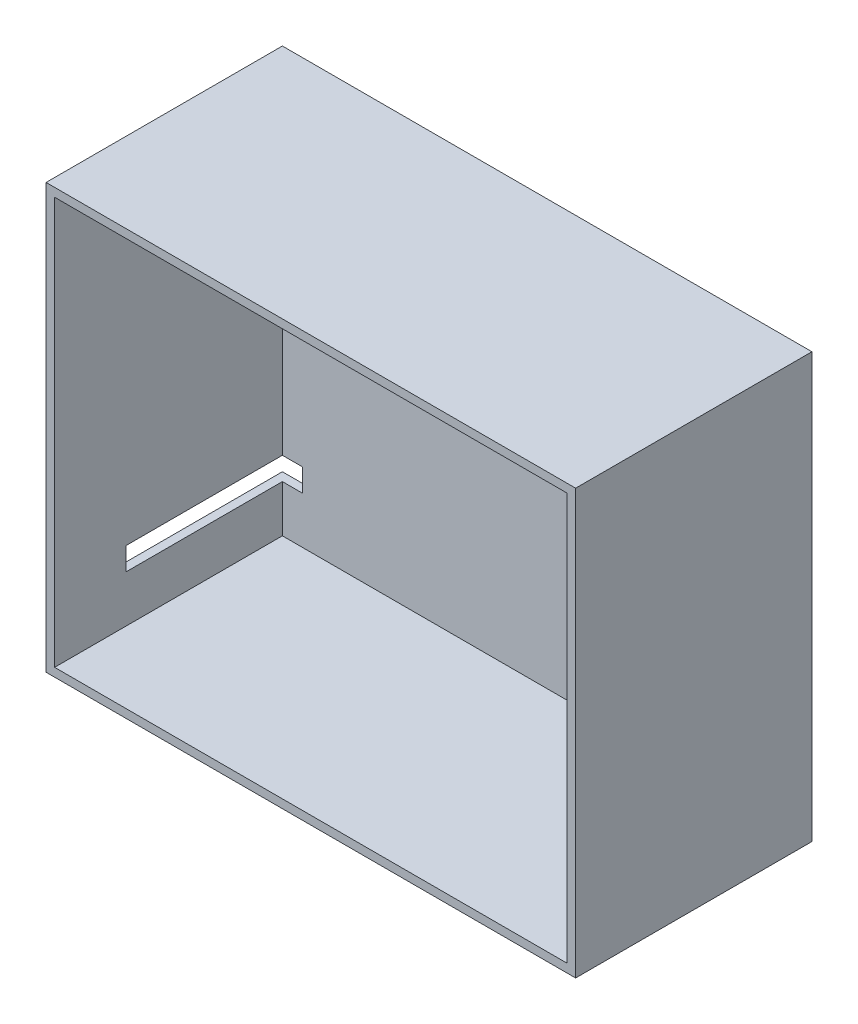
SolidWorks part; units mm, degrees
ref_plane "前视基准面" through (0, 0, 0) normal (0, 0, 1) x (1, 0, 0)
ref_plane "上视基准面" through (0, 0, 0) normal (0, 1, 0) x (1, 0, 0)
ref_plane "右视基准面" through (0, 0, 0) normal (1, 0, 0) x (0, 0, -1)
other "Configuration Table"
sketch "草图1" plane through (0, 0, 0) normal (0, 0, 1) x (1, 0, 0)
  line L1 (0, 0) -> (186, 0)
  line L2 (0, 0) -> (0, 149)
  line L3 (0, 149) -> (186, 149)
  line L4 (186, 0) -> (186, 149)
extrude "Floor_T3" add sketch "草图1" along normal blind 3
sketch "草图2" plane through (0, 0, 0) normal (0, 0, 1) x (1, 0, 0)
  line L1 (0, 0) -> (186, 0)
  line L2 (0, 0) -> (0, 149)
  line L3 (0, 149) -> (186, 149)
  line L4 (186, 0) -> (186, 149)
  line L6 (3, 3) -> (183, 3)
  line L7 (3, 3) -> (3, 146)
  line L8 (3, 146) -> (183, 146)
  line L9 (183, 3) -> (183, 146)
extrude "Walls_T3_depth80" add sketch "草图2" along normal blind 83
sketch "草图3" plane through (0, 0, 0) normal (0, 0, 1) x (1, 0, 0)
  line L1 (-1, 19.5) -> (10, 19.5)
  line L2 (-1, 19.5) -> (-1, 27.5)
  line L3 (-1, 27.5) -> (10, 27.5)
  line L4 (10, 19.5) -> (10, 27.5)
extrude "Servo_stand_relief_W8_H58" cut sketch "草图3" along normal blind 58
